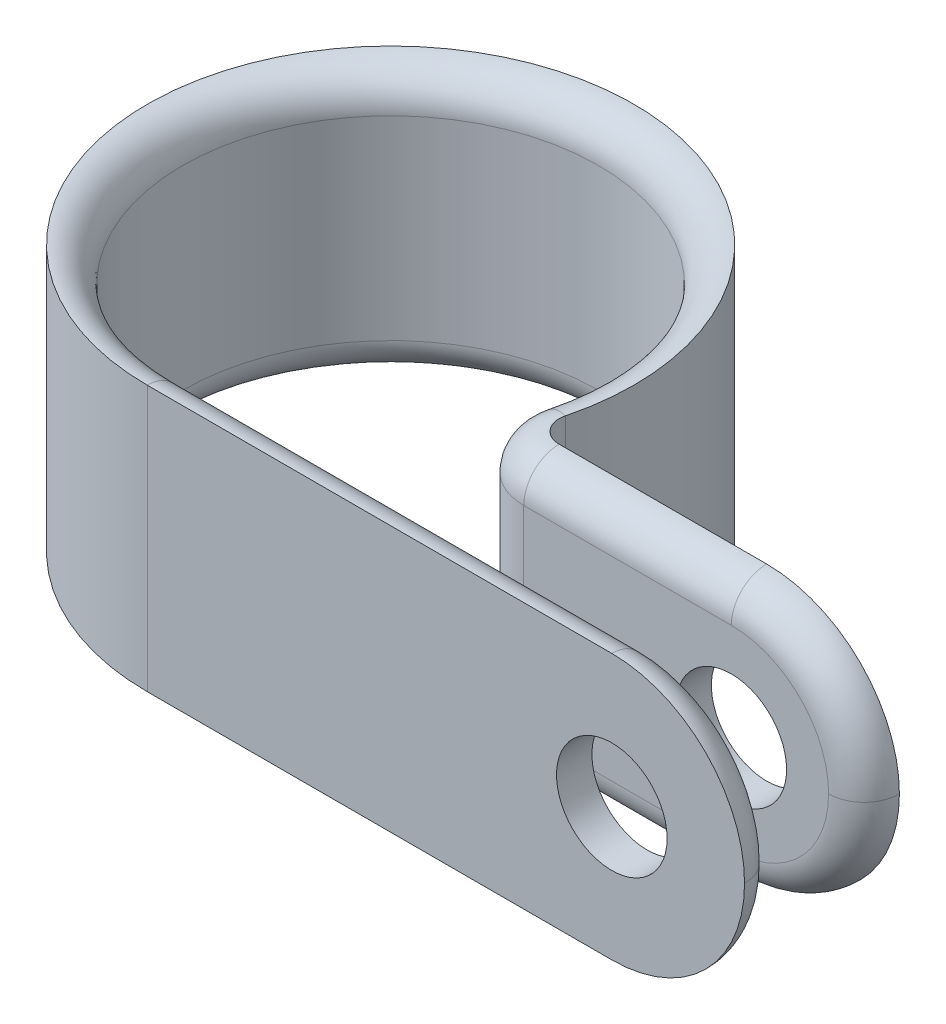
SolidWorks part; units mm, degrees
ref_plane "Plan de face" through (0, 0, 0) normal (0, 0, 1) x (1, 0, 0)
ref_plane "Plan de dessus" through (0, 0, 0) normal (0, 1, 0) x (1, 0, 0)
ref_plane "Plan de droite" through (0, 0, 0) normal (1, 0, 0) x (0, 0, -1)
sketch "Esquisse1" plane through (0, 0, 0) normal (0, 1, 0) x (1, 0, 0)
  line L0 (0, -11) -> (35.5223, -11) construction
  line L1 (0, -12.2891) -> (0, 16.001) construction
  line L2 (-17.9087, 0) -> (21.911, 0) construction
  line L3 (33.494, -4) -> (9.2605, -4) construction
  line L4 (27, 16.001) -> (27, -12.2891) construction
  line L5 (-12.9445, -9.4) -> (32.6399, -9.4) construction
  line L6 (5.8444, -5.6) -> (32.6399, -5.6) construction
  line L7 (11.619, -4) -> (27, -4)
  line L8 (27, -4) -> (27, -5.6)
  line L9 (27, -5.6) -> (11.619, -5.6)
  line L10 (0, -9.4) -> (27, -9.4)
  line L11 (27, -9.4) -> (27, -11)
  line L12 (27, -11) -> (0, -11)
  line L13 (11.619, -3.5691) -> (11.619, -0.5946) construction
  line L14 (13.4433, -3) -> (11.2631, -3) construction
  arc A0 (9.1015, -2.35) -> (0, -9.4) centre (0, 0) ccw
  arc A1 (10.6507, -2.75) -> (0, -11) centre (0, 0) ccw
  arc A2 (10.6507, -2.75) -> (11.619, -4) centre (11.619, -3) ccw
  arc A3 (9.1015, -2.35) -> (11.619, -5.6) centre (11.619, -3) ccw
  dimension "D1" = 7
  dimension "D3" = 1.6
  dimension "D4" = 1.6
  dimension "D2" = 27
extrude "Extrusion1" add sketch "Esquisse1" along normal blind 12
fillet "Congé1" radius 6 8 edges at (27, 12, 4.8) (27, 0, 4.8) (27, 6, 9.4) (27, 6, 11) (27, 6, 4) (27, 6, 5.6) (27, 12, 10.2) (27, 0, 10.2)
fillet "Congé2" radius 1.6 18 edges at (16.3095, 0, 5.6) (9.5635, 0, 4.5922) (10.5, 0, 9.4) (10.5, 12, 9.4) (25.2426, 10.2426, 9.4) (25.2426, 1.7574, 9.4) (21, 0, 4.8) (21, 0, 10.2) (-5.7563, 12, -7.4314) (25.2426, 10.2426, 5.6) (25.2426, 1.7574, 5.6) (21, 12, 10.2) (21, 12, 4.8) (27, 6, 10.2) (9.5635, 12, 4.5922) (27, 6, 4.8) (16.3095, 12, 5.6) (-5.7563, 0, -7.4314)
sketch "Esquisse3" plane through (0, 0, 11) normal (0, 0, 1) x (1, 0, 0)
  line L0 (21, 17.2755) -> (21, 3.7171) construction
  line L1 (30.3686, 6) -> (18.4386, 6) construction
  circle A0 centre (21, 6) radius 2.5
extrude "Enlèv. mat.-Extru.1" cut sketch "Esquisse3" against normal through all
sketch "Esquisse4" plane through (0, 0, 4) normal (0, 0, -1) x (-1, 0, 0)
  text T0 "www.a4.fr" font "Arial" height 0.01
extrude "Enlèv. mat.-Extru.2" cut sketch "Esquisse4" against normal blind 0.01
